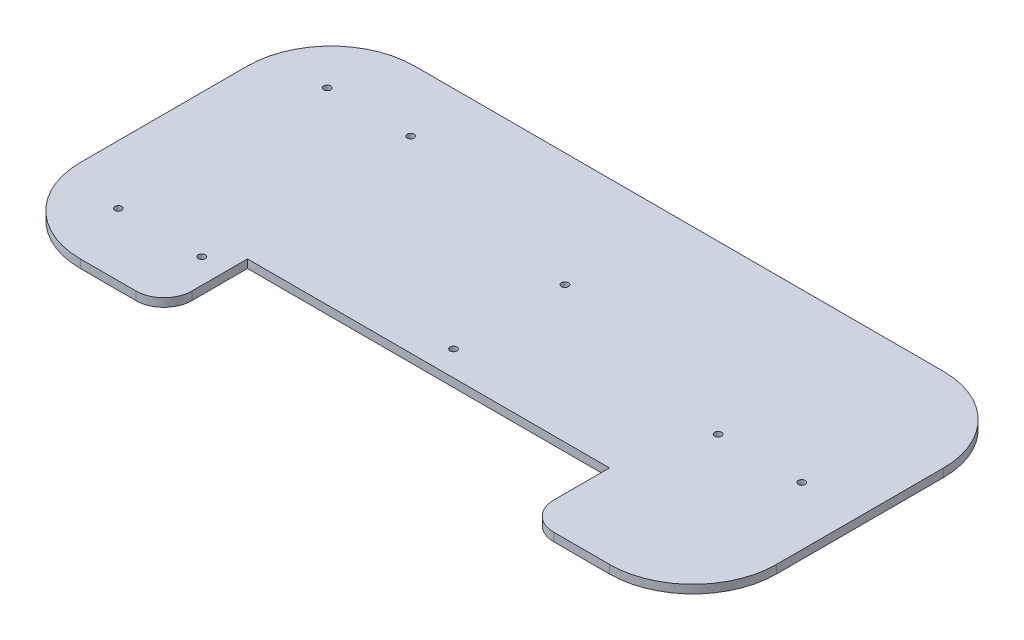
SolidWorks part; units mm, degrees
ref_plane "Alzado" through (0, 0, 0) normal (0, 0, 1) x (1, 0, 0)
ref_plane "Planta" through (0, 0, 0) normal (0, 1, 0) x (1, 0, 0)
ref_plane "Vista lateral" through (0, 0, 0) normal (1, 0, 0) x (0, 0, -1)
sketch "Croquis1" plane through (0, 0, 0) normal (0, 1, 0) x (1, 0, 0)
  line L1 (-125, 60) -> (125, 60)
  line L2 (-125, 60) -> (-125, -60)
  line L3 (-125, -60) -> (125, -60)
  line L4 (125, 60) -> (125, -60)
  line L5 (-125, 60) -> (125, -60) construction
  line L6 (-125, -60) -> (125, 60) construction
  point P0 (0, 0)
  dimension "D1" = 250
  dimension "D2" = 120
extrude "Saliente-Extruir1" add sketch "Croquis1" along normal blind 3
fillet "Redondeo1" radius 30 4 edges at (-125, 1.5, -60) (-125, 1.5, 60) (125, 1.5, -60) (125, 1.5, 60)
sketch "Croquis2" plane through (0, 0, 0) normal (0, -1, 0) x (1, 0, 0)
  line L0 (-95, 60) -> (95, 60) construction
  line L1 (-65, 60) -> (65, 60)
  line L2 (-65, 60) -> (-65, 30)
  line L3 (-65, 30) -> (65, 30)
  line L4 (65, 60) -> (65, 30)
  line L5 (-125, -30) -> (-125, 30) construction
  line L6 (125, 30) -> (125, -30) construction
  dimension "D1" = 60
  dimension "D2" = 60
  dimension "D3" = 30
extrude "Cortar-Extruir1" cut sketch "Croquis2" against normal blind 10
fillet "Redondeo2" radius 10 2 edges at (-65, 1.5, 60) (65, 1.5, 60)
sketch "Croquis3" plane through (0, 0, 0) normal (0, -1, 0) x (1, 0, 0)
  circle A0 centre (104.0287, 0) radius 1.25
  circle A1 centre (74.0287, 0) radius 1.25
  circle A2 centre (0, 21) radius 1.25
  circle A3 centre (0, -19) radius 1.25
  circle A4 centre (-73.8835, 37.5) radius 1.25
  circle A5 centre (-103.8835, 37.5) radius 1.25
  circle A6 centre (-103.8835, 37.5) radius 1.25 construction
  circle A7 centre (-73.8835, 37.5) radius 1.25 construction
  circle A8 centre (0, -19) radius 1.25 construction
  circle A9 centre (0, 21) radius 1.25 construction
  circle A10 centre (74.0287, 0) radius 1.25 construction
  circle A11 centre (104.0287, 0) radius 1.25 construction
  circle A12 centre (-103.8835, -37.5) radius 1.25
  circle A13 centre (-73.8835, -37.5) radius 1.25
extrude "Cortar-Extruir2" cut sketch "Croquis3" against normal through all
